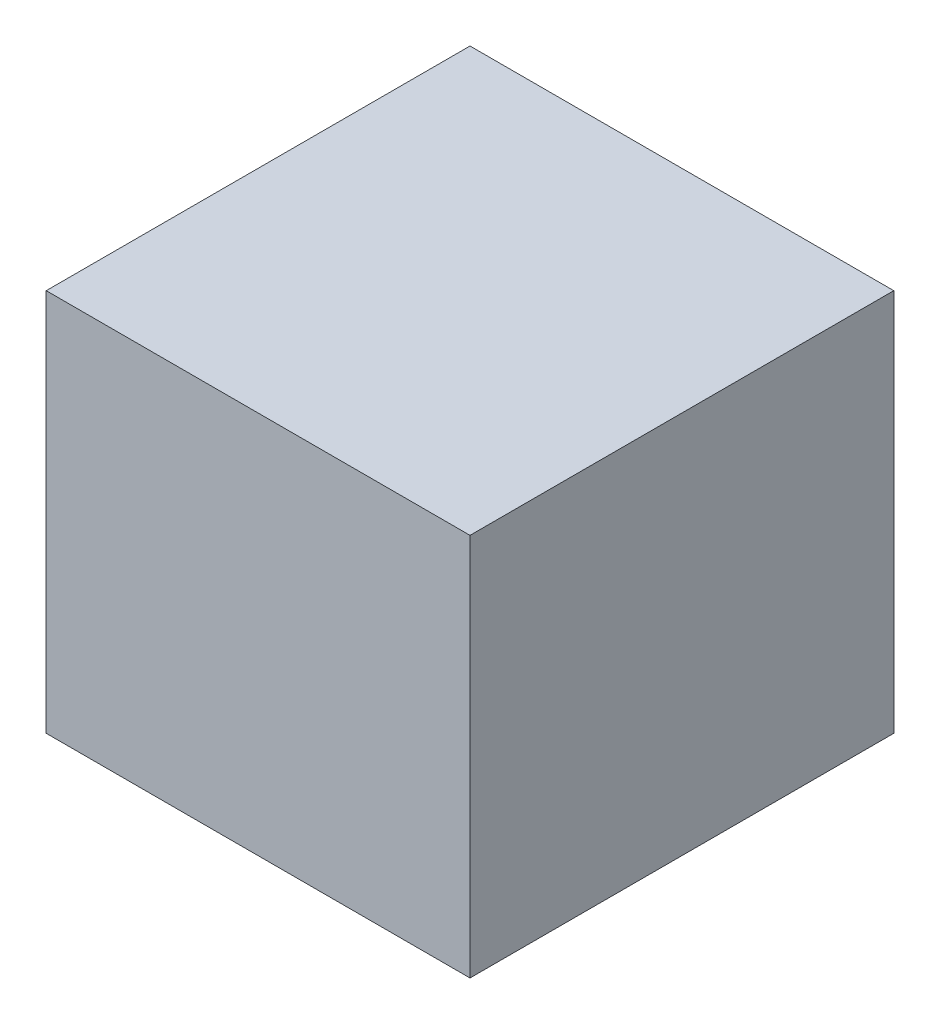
SolidWorks part; units mm, degrees
ref_plane "Front" through (0, 0, 0) normal (0, 0, 1) x (1, 0, 0)
ref_plane "Top" through (0, 0, 0) normal (0, 1, 0) x (1, 0, 0)
ref_plane "Right" through (0, 0, 0) normal (1, 0, 0) x (0, 0, -1)
sketch "Sketch1" plane through (0, 0, 0) normal (0, 1, 0) x (1, 0, 0)
  line L1 (0, 0) -> (57.0395, 0)
  line L2 (0, 0) -> (0, 57.0395)
  line L3 (0, 57.0395) -> (57.0395, 57.0395)
  line L4 (57.0395, 0) -> (57.0395, 57.0395)
extrude "Extrude1" add sketch "Sketch1" against normal blind 51.5986
